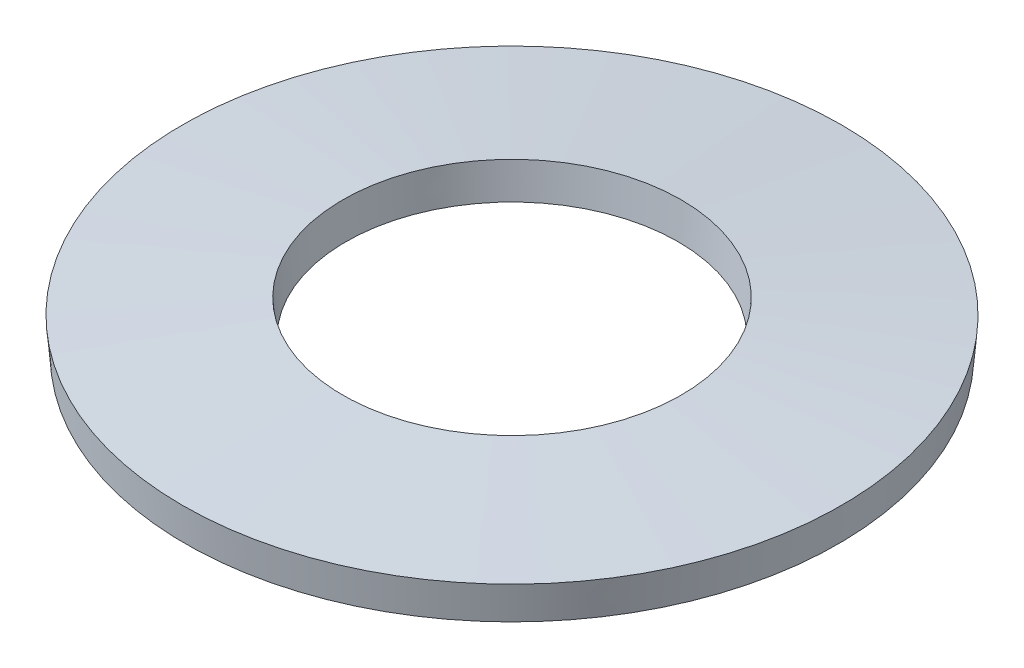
SolidWorks part; units mm, degrees
ref_plane "Piano frontale" through (0, 0, 0) normal (0, 0, 1) x (1, 0, 0)
ref_plane "Piano superiore" through (0, 0, 0) normal (0, 1, 0) x (1, 0, 0)
ref_plane "Piano destro" through (0, 0, 0) normal (1, 0, 0) x (0, 0, -1)
sketch "Schizzo1" plane through (0, 0, 0) normal (0, 0, 1) x (1, 0, 0)
  line L0 (0, 0) -> (0, 35.6454) construction
  line L1 (0, 15.9427) -> (14.25, 15.9427)
  line L2 (14.25, 15.9427) -> (14.5115, 18.9313)
  line L3 (14.5115, 18.9313) -> (0, 18.9313)
  line L4 (0, 14.6313) -> (28, 14.6313)
  line L5 (28, 14.6313) -> (28.2615, 17.6199)
  line L6 (28.2615, 17.6199) -> (14.5115, 18.9313)
  line L7 (14.25, 15.9427) -> (28, 14.6313)
  dimension "D1" = 4.3
  dimension "D2" = 3
  dimension "D3" = 28
  dimension "D4" = 14.25
revolve "Rivoluzione1" add sketch "Schizzo1" angle 360 about L0
